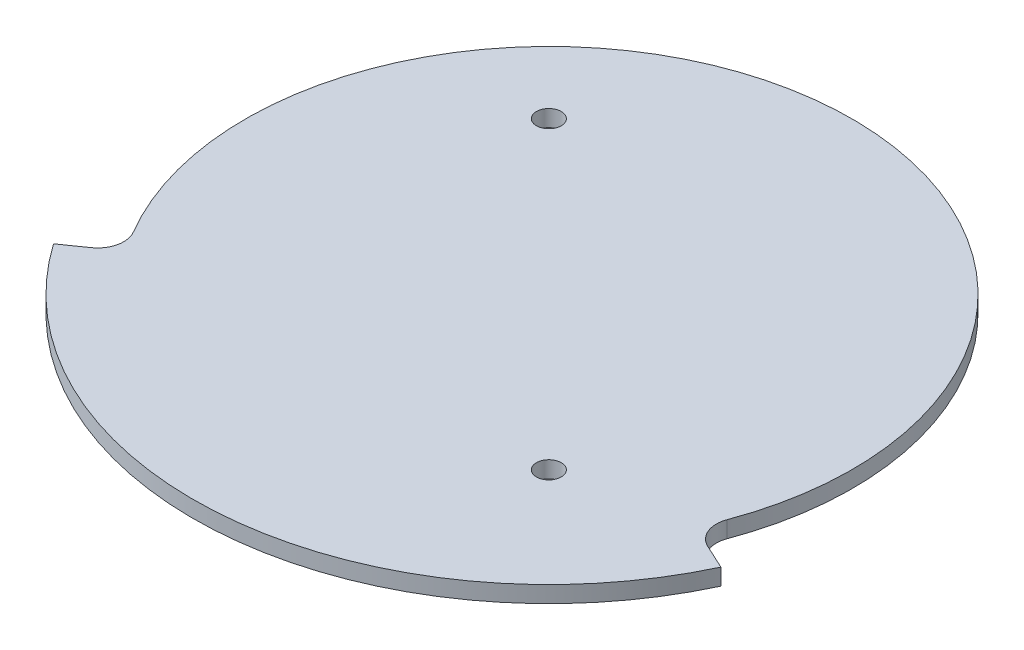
SolidWorks part; units mm, degrees
ref_plane "Front Plane" through (0, 0, 0) normal (0, 0, 1) x (1, 0, 0)
ref_plane "Top Plane" through (0, 0, 0) normal (0, 1, 0) x (1, 0, 0)
ref_plane "Right Plane" through (0, 0, 0) normal (1, 0, 0) x (0, 0, -1)
sketch "Sketch1" plane through (0, 0, 0) normal (0, 1, 0) x (1, 0, 0)
  circle A0 centre (0, 0) radius 136.5
  dimension "D1" = 273
extrude "Boss-Extrude1" add sketch "Sketch1" along normal blind 6.35
sketch "Sketch2" plane through (0, 6.35, 0) normal (0, 1, 0) x (1, 0, 0)
  line L0 (0, 0) -> (-111.8143, -78.2932) construction
  line L1 (0, 0) -> (123.711, -57.6874) construction
  line L2 (0, 0) -> (-136.5, 0) construction
  line L3 (-103.2985, -72.3304) -> (-111.8143, -78.2932)
  line L4 (114.2891, -53.2939) -> (123.711, -57.6874)
  circle A0 centre (0, 0) radius 136.5 construction
  arc A1 (-103.2985, -72.3304) -> (-100.4149, -59.0686) centre (-109.0342, -64.1388) ccw
  arc A2 (123.711, -57.6874) -> (-111.8143, -78.2932) centre (0, 0) ccw
  circle A3 centre (0, 0) radius 116.5
  arc A4 (109.1465, -40.7343) -> (-100.4149, -59.0686) centre (0, 0) ccw
  arc A5 (109.1465, -40.7343) -> (114.2891, -53.2939) centre (118.5153, -44.2308) ccw
  dimension "D1" = 20
  dimension "D2" = 120
  dimension "D3" = 155
extrude "Cut-Extrude1" cut sketch "Sketch2" against normal through all
sketch "Sketch3" plane through (0, 6.35, 0) normal (0, 1, 0) x (1, 0, 0)
  line L0 (0, 0) -> (82.3779, -82.3779) construction
  line L1 (0, 0) -> (0, 116.5) construction
  circle A1 centre (58.3717, -58.3717) radius 4.7625
  arc A2 (109.1465, -40.7343) -> (-100.4149, -59.0686) centre (0, 0) ccw construction
  circle A3 centre (-58.3717, 58.3717) radius 4.7625
  point P13 (0, 0)
  dimension "D1" = 9.525
  dimension "D3" = 82.55
  dimension "D2" = 135
  dimension "D4" = 2
extrude "Cut-Extrude2" cut sketch "Sketch3" against normal up to next
